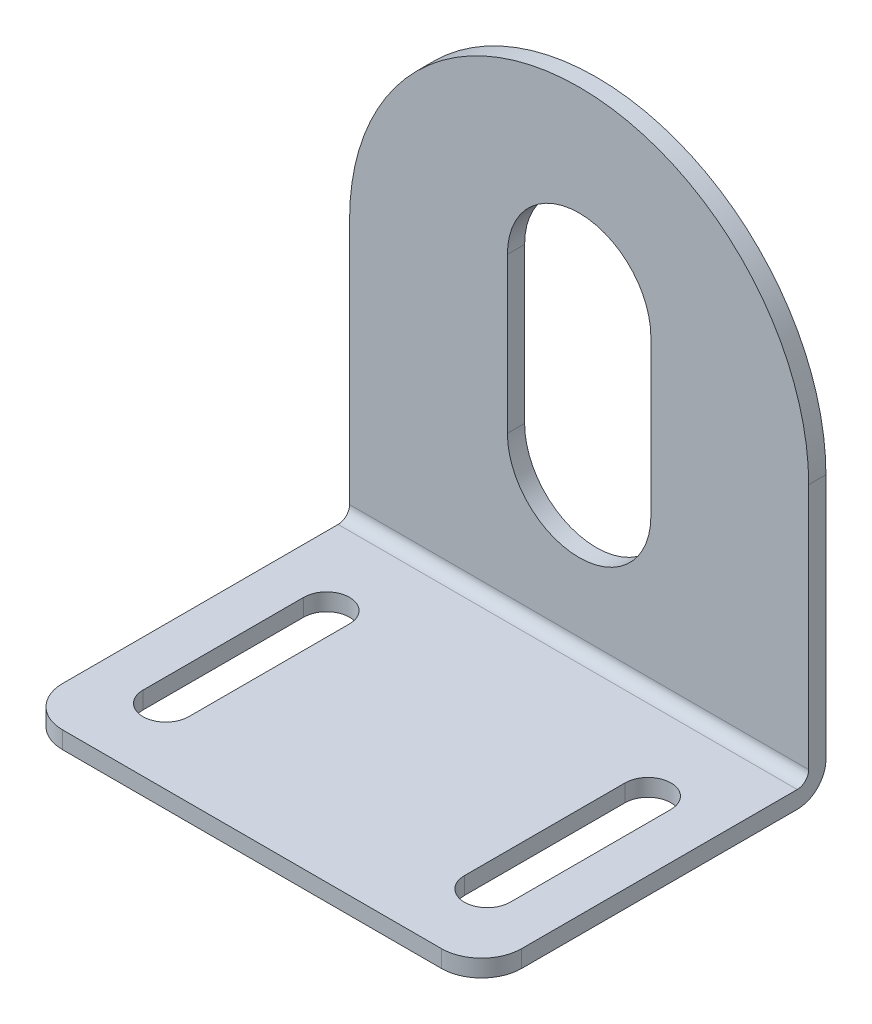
SolidWorks part; units mm, degrees
other "Markup1"
sketch "Sketch6" plane through (20, 42.5, -1.5) normal (0.4839, 0.0899, -0.8705) x (-0.8702, -0.0564, -0.4895)
ref_plane "Front Plane" through (0, 0, 0) normal (0, 0, 1) x (1, 0, 0)
ref_plane "Top Plane" through (0, 0, 0) normal (0, 1, 0) x (1, 0, 0)
ref_plane "Right Plane" through (0, 0, 0) normal (1, 0, 0) x (0, 0, -1)
sketch "Sketch3" plane through (0, 0, 0) normal (1, 0, 0) x (0, 0, -1)
  line L0 (-30, 0) -> (0, 0)
  line L1 (0, 0) -> (0, 42.5)
  dimension "D1" = 30
  dimension "D2" = 42.5
extrude "Extrude-Thin1" add sketch "Sketch3" along normal mid plane 40 thin contours L0 L1
sketch "Sketch4" plane through (0, 0, -1.5) normal (0, 0, -1) x (-1, 0, 0)
  line L6 (-20, -1.5) -> (-20, 42.5) construction
  line L7 (-20, 42.5) -> (20, 42.5) construction
  line L8 (-20, 22.5) -> (-20, 51.8642)
  line L9 (-20, 51.8642) -> (20, 51.8642)
  line L10 (20, 51.8642) -> (20, 22.5)
  arc A1 (20, 22.5) -> (-20, 22.5) centre (0, 22.5) ccw
  point P1 (0, 42.5)
  dimension "D2" = 40
fillet "Fillet1" radius 2.5 1 edges at (0, -1.5, -1.5)
fillet "Fillet2" radius 1 1 edges at (0, 0, 0)
extrude "Cut-Extrude2" cut sketch "Sketch4" against normal blind 10 contours L9 L10 A1 L8
sketch "Sketch5" plane through (0, 0, 0) normal (0, 0, 1) x (1, 0, 0)
  line L0 (0, 13.25) -> (0, 26.75) construction
  line L1 (-6.25, 13.25) -> (-6.25, 26.75)
  line L2 (6.25, 13.25) -> (6.25, 26.75)
  arc A0 (-6.25, 13.25) -> (6.25, 13.25) centre (0, 13.25) ccw
  arc A1 (6.25, 26.75) -> (-6.25, 26.75) centre (0, 26.75) ccw
  arc A2 (20, 22.5) -> (-20, 22.5) centre (0, 22.5) ccw construction
  point P3 (0, 20)
  point P8 (0, 33)
  point P9 (0, 7)
  point P10 (0, 42.5)
  dimension "D2" = 26
  dimension "D1" = 12.5
  dimension "D3" = 9.5
extrude "Cut-Extrude3" cut sketch "Sketch5" against normal blind 10 contours A1 L1 A0 L2
sketch "Sketch8" plane through (0, 0, 30) normal (0, 0, 1) x (1, 0, 0)
  line L1 (-20, 0) -> (20, 0)
  line L2 (-20, 0) -> (-20, -1.5)
  line L3 (-20, -1.5) -> (20, -1.5)
  line L4 (20, 0) -> (20, -1.5)
extrude "Cut-Extrude5" cut sketch "Sketch8" against normal blind 1.5
sketch "Sketch9" plane through (0, -1.5, 0) normal (0, -1, 0) x (1, 0, 0)
  line L0 (-14, 22) -> (-14, 8) construction
  line L1 (-12, 22) -> (-12, 8)
  line L2 (-16, 22) -> (-16, 8)
  line L3 (20, -1.5) -> (-20, -1.5) construction
  line L4 (-20, 28.5) -> (-20, 1) construction
  line L6 (0, -16.5) -> (0, 16.5) construction
  line L7 (14, 22) -> (14, 8) construction
  line L8 (12, 22) -> (12, 8)
  line L9 (16, 22) -> (16, 8)
  arc A0 (-12, 22) -> (-16, 22) centre (-14, 22) ccw
  arc A1 (-16, 8) -> (-12, 8) centre (-14, 8) ccw
  arc A2 (12, 22) -> (16, 22) centre (14, 22) cw
  arc A3 (16, 8) -> (12, 8) centre (14, 8) cw
  point P2 (-14, 15)
  point P15 (14, 15)
  dimension "D2" = 9.5
  dimension "D3" = 14
  dimension "D1" = 4
  dimension "D4" = 4
extrude "Cut-Extrude6" cut sketch "Sketch9" against normal blind 1.5
fillet "Fillet3" radius 3.5 2 edges at (20, -0.75, 28.5) (-20, -0.75, 28.5)
